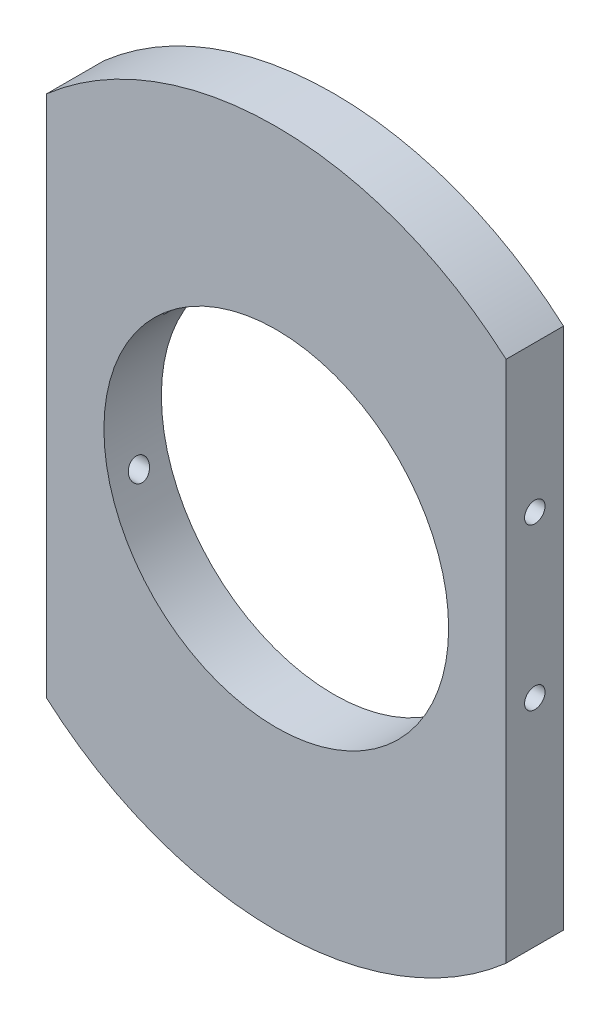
SolidWorks part; units mm, degrees
ref_plane "Front Plane" through (0, 0, 0) normal (0, 0, 1) x (1, 0, 0)
ref_plane "Top Plane" through (0, 0, 0) normal (0, 1, 0) x (1, 0, 0)
ref_plane "Right Plane" through (0, 0, 0) normal (1, 0, 0) x (0, 0, -1)
sketch "Sketch1" plane through (0, 0, 0) normal (0, 0, 1) x (1, 0, 0)
  circle A0 centre (0, 0) radius 38.481
  dimension "D1" = 76.962
extrude "Extrude1" add sketch "Sketch1" along normal blind 6.35
sketch "Sketch4" plane through (0, 0, 6.35) normal (0, 0, 1) x (1, 0, 0)
  circle A0 centre (0, 0) radius 19.05
  circle A1 centre (0, 0) radius 38.481 construction
  dimension "D1" = 38.1
extrude "Extrude2" cut sketch "Sketch4" against normal through all
sketch "Sketch5" plane through (0, 0, 6.35) normal (0, 0, 1) x (1, 0, 0)
  line L1 (-25.4, 41.123) -> (25.4, 41.123)
  line L2 (-25.4, 41.123) -> (-25.4, -49.042)
  line L3 (-25.4, -49.042) -> (25.4, -49.042)
  line L4 (25.4, 41.123) -> (25.4, -49.042)
  dimension "D1" = 50.8
  dimension "D2" = 25.4
extrude "Extrude3" cut sketch "Sketch5" against normal through all flip side to cut
chamfer "Chamfer1" [suppressed] distance 1.27 angle 45
hole_wizard "#4-40 Tapped Hole1" positions "3DSketch1" profile "Sketch6" tap size "#4-40" standard "Ansi Inch"
sketch3d "3DSketch1"
  line L0 (25.4, -28.9072, 6.35) -> (25.4, 28.9072, 6.35) construction
  point P0 (25.4, 12.7, 3.175)
  point P2 (25.4, -5.08, 3.175)
  dimension "D1" = 17.78
  dimension "D2" = 12.7
  dimension "D3" = 3.175
sketch "Sketch6" plane through (25.4, 12.7, 3.175) normal (0, 1, 0) x (0, 0, -1)
  line L0 (0, 0) -> (0, 12.1092)
  line L1 (0, 12.1092) -> (1.1303, 11.43)
  line L2 (1.1303, 11.43) -> (1.1303, 0)
  line L5 (1.1303, 0) -> (0, 0)
  line L10 (0, 12.1092) -> (-1.1303, 11.43) construction
  line L11 (0, -6.35) -> (0, 107.95) construction
  dimension "Tap Drill Dia." = 2.2606
  dimension "Tap Drill Depth" = 11.43
  dimension "Drill Angle" = 118
mirror "Mirror1" about plane through (0, 0, 0) normal (1, 0, 0) of "#4-40 Tapped Hole1"
sketch "Sketch7" plane through (0, 0, 0) normal (0, 0, 1) x (1, 0, 0)
  circle A0 centre (0, 0) radius 19.05 construction
  point P0 (-6.35, -27.6098)
  point P1 (6.35, -27.6098)
  dimension "D3" = 6.35
  dimension "D1" = 27.6098
  dimension "D2" = 12.7
hole_wizard "CSK for #10 Flat Head Machine Screw (100)1" positions "3DSketch2" profile "Sketch8" countersink size "#10" standard "Ansi Inch"
sketch3d "3DSketch2"
  point P0 (-6.35, -27.6098, 0)
  point P3 (6.35, -27.6098, 0)
sketch "Sketch8" plane through (-6.35, -27.6098, 0) normal (1, 0, 0) x (0, 1, 0)
  line L0 (0, 0) -> (0, 6.35)
  line L1 (0, 6.35) -> (2.5527, 6.35)
  line L2 (2.5527, 6.35) -> (2.5527, 1.9608)
  line L3 (2.5527, 1.9608) -> (4.8895, 0)
  line L5 (4.8895, 0) -> (0, 0)
  line L6 (-2.5527, 1.9608) -> (-4.8895, 0) construction
  line L11 (0, -6.35) -> (0, 107.95) construction
  dimension "Thru Hole Dia." = 5.1054
  dimension "Thru Hole Depth" = 6.35
  dimension "Near C'Sink Dia." = 9.779
  dimension "Near C'Sink Angle" = 100
